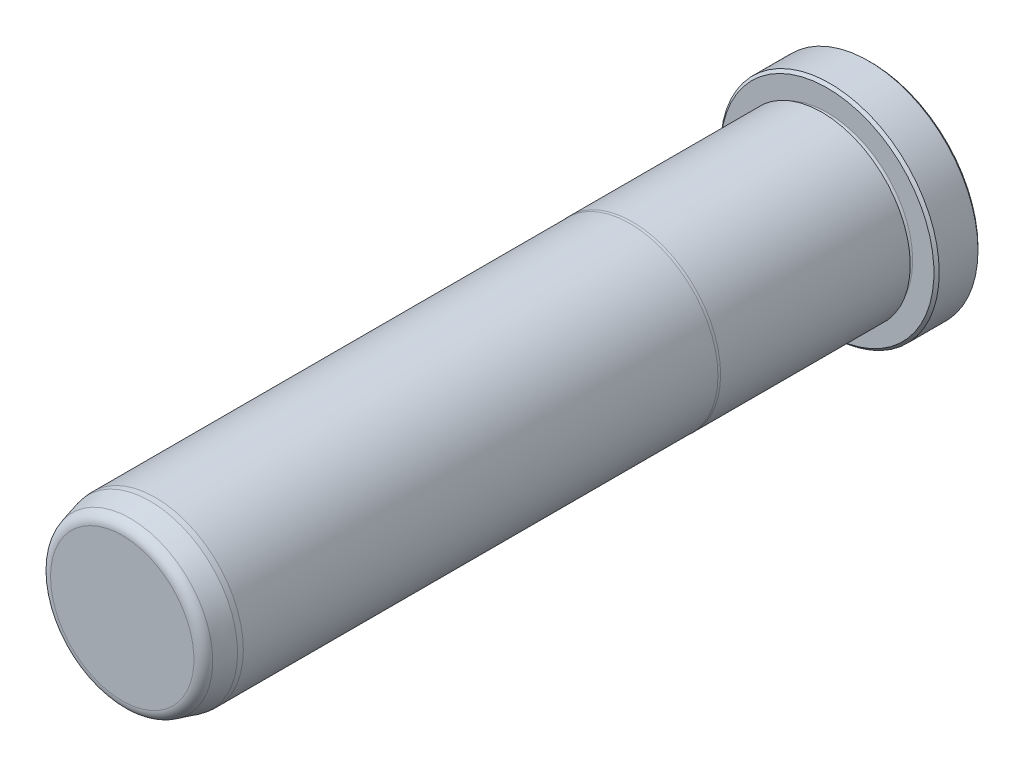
SolidWorks part; units mm, degrees
ref_plane "Front Plane" through (0, 0, 0) normal (0, 0, 1) x (1, 0, 0)
ref_plane "Top Plane" through (0, 0, 0) normal (0, 1, 0) x (1, 0, 0)
ref_plane "Right Plane" through (0, 0, 0) normal (1, 0, 0) x (0, 0, -1)
sketch "Sketch1" plane through (0, 0, 0) normal (1, 0, 0) x (0, 0, -1)
  line L0 (0, 0) -> (0, 15.748)
  line L1 (0, 15.748) -> (-6.35, 15.748)
  line L2 (-6.35, 15.748) -> (-6.35, 12.3063)
  line L3 (-6.35, 11.9253) -> (-7.112, 11.9253) construction
  line L4 (-7.112, 12.3063) -> (-7.112, 12.7127)
  line L5 (-7.112, 12.7127) -> (-34.4348, 12.7127)
  line L6 (-34.4348, 12.7127) -> (-34.798, 12.6873)
  line L7 (-34.798, 12.6873) -> (-103.1875, 12.6873)
  line L9 (-107.95, 11.5487) -> (-107.95, 0)
  line L10 (-107.95, 0) -> (0, 0)
  line L11 (0, 0) -> (13.6287, 0) construction
  line L12 (-103.1875, 12.6873) -> (-103.9495, 12.6206)
  line L13 (-103.9495, 12.6206) -> (-107.95, 11.5487)
  arc A0 (-7.112, 12.3063) -> (-6.35, 12.3063) centre (-6.731, 12.3063) ccw
  dimension "D14" = 0.762
  dimension "D1" = 6.35
  dimension "D2" = 0.762
  dimension "D3" = 31.496
  dimension "D4" = 25.4254
  dimension "D5" = 34.798
  dimension "D6" = 107.95
  dimension "D7" = 0.7874
  dimension "D8" = 4
  dimension "D9" = 25.3746
  dimension "D10" = 5
  dimension "D11" = 15
  dimension "D12" = 0.762
  dimension "D13" = 4.7625
revolve "Revolve1" add sketch "Sketch1" angle 360 about L11
fillet "Fillet6" radius 1.5875 1 edges at (11.5487, 0, 107.95)
chamfer "Chamfer1" distance 0.381 angle 45 2 edges at (15.748, 0, 0) (15.748, 0, 6.35)
